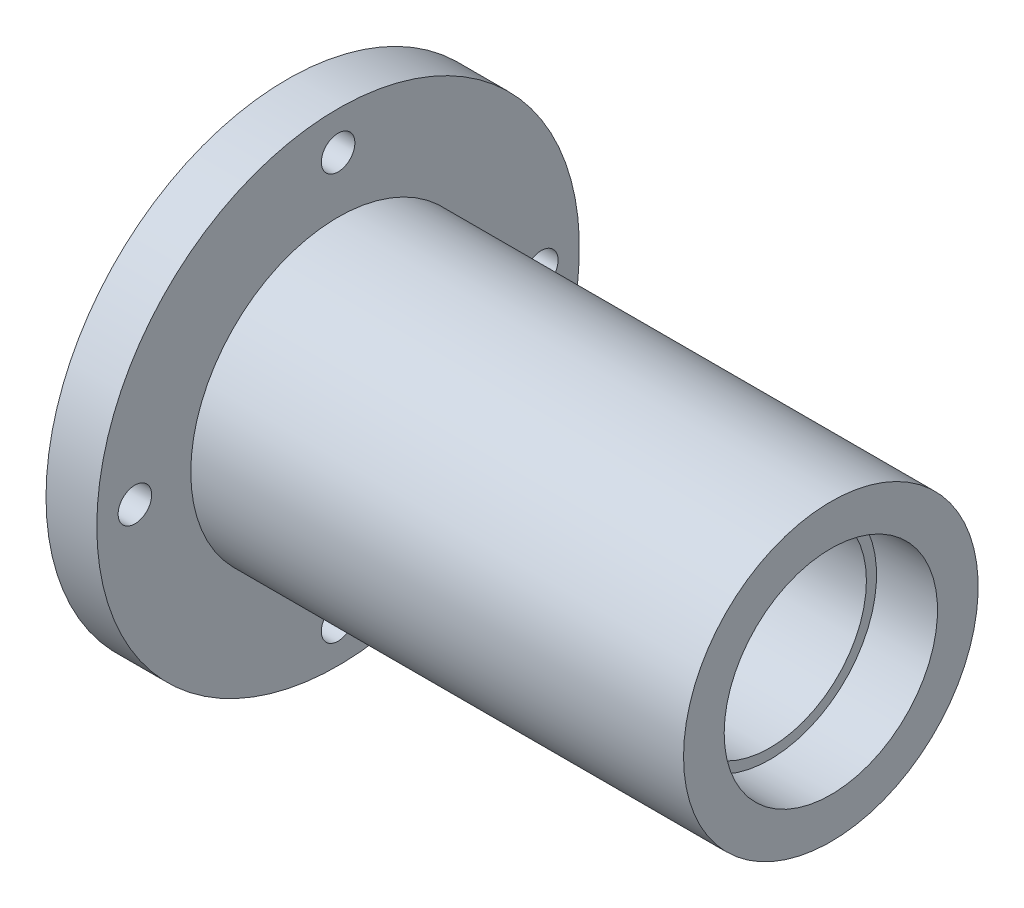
SolidWorks part; units mm, degrees
ref_plane "Plan1" through (0, 0, 0) normal (0, 0, 1) x (1, 0, 0)
ref_plane "Plan2" through (0, 0, 0) normal (0, 1, 0) x (1, 0, 0)
ref_plane "Plan3" through (0, 0, 0) normal (1, 0, 0) x (0, 0, -1)
sketch "Esquisse1" plane through (0, 0, 0) normal (0, 0, 1) x (1, 0, 0)
  line L0 (0, 22.5) -> (0, 30)
  line L1 (0, 30) -> (3, 30)
  line L2 (3, 30) -> (3, 47.5)
  line L3 (3, 47.5) -> (13, 47.5)
  line L4 (13, 47.5) -> (13, 29)
  line L5 (13, 29) -> (110, 29)
  line L6 (110, 29) -> (110, 21)
  line L7 (110, 21) -> (98, 21)
  line L8 (98, 21) -> (98, 19)
  line L9 (98, 19) -> (32, 19)
  line L10 (32, 19) -> (32, 21)
  line L11 (32, 21) -> (20, 21)
  line L12 (20, 21) -> (20, 22.5)
  line L13 (20, 22.5) -> (0, 22.5)
  line L14 (-23.2546, 0) -> (141.0781, 0) construction
  dimension "D1" = 21
  dimension "D2" = 19
  dimension "D3" = 21
  dimension "D4" = 29
  dimension "D5" = 47.5
  dimension "D6" = 30
  dimension "D7" = 3
  dimension "D8" = 10
  dimension "D9" = 97
  dimension "D10" = 12
  dimension "D11" = 66
  dimension "D12" = 12
  dimension "D13" = 22.5
revolve "Base-Révolution" add sketch "Esquisse1" angle 360 about L14
hole_wizard "Perçage1" positions "Esquisse6" profile "Esquisse5" hole size "M6" standard "ISO"
sketch "Esquisse6" plane through (3, 0, 0) normal (-1, 0, 0) x (0, 0, 1)
  circle A0 centre (0, 0) radius 47.5 construction
  point P0 (0, 40)
  point P1 (40, 0)
  point P2 (-40, 0)
  point P3 (0, -40)
  dimension "D1" = 40
  dimension "D4" = 40
  dimension "D2" = 40
  dimension "D3" = 40
sketch "Esquisse5" plane through (3, 40, 0) normal (0, 1, 0) x (0, 0, 1)
  line L0 (0, 0) -> (0, 107)
  line L1 (0, 107) -> (3.3, 107)
  line L2 (3.3, 107) -> (3.3, 0)
  line L5 (3.3, 0) -> (0, 0)
  line L11 (0, -6.35) -> (0, 107.95) construction
  dimension "Diamètre du perçage jusqu'au prochain" = 6.6
  dimension "Profondeur du perçage jusqu'au prochain" = 107
